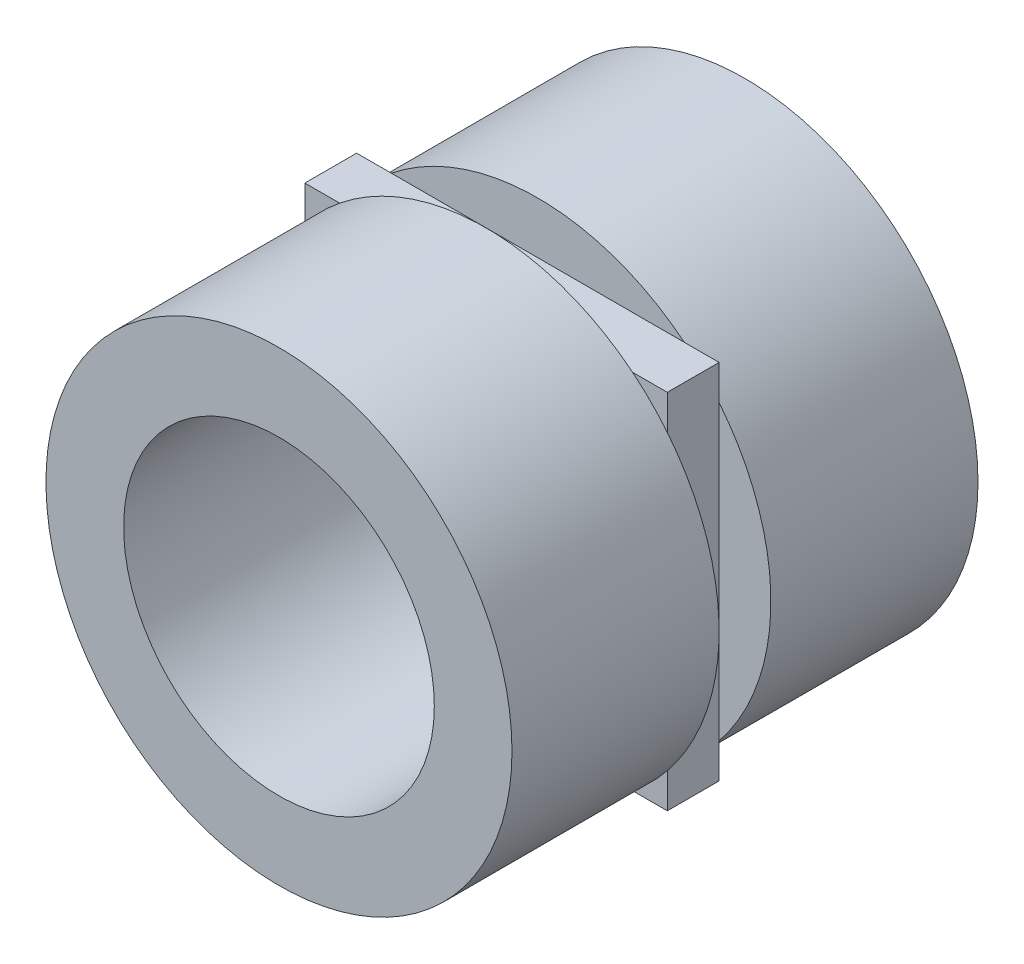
SolidWorks part; units mm, degrees
ref_plane "Plan de face" through (0, 0, 0) normal (0, 0, 1) x (1, 0, 0)
ref_plane "Plan de dessus" through (0, 0, 0) normal (0, 1, 0) x (1, 0, 0)
ref_plane "Plan de droite" through (0, 0, 0) normal (1, 0, 0) x (0, 0, -1)
sketch "Esquisse1" plane through (0, 0, 0) normal (0, 0, 1) x (1, 0, 0)
  circle A0 centre (0, 0) radius 4.5
  circle A1 centre (0, 0) radius 3
  dimension "D1" = 9
  dimension "D2" = 6
extrude "Extrusion1" add sketch "Esquisse1" along normal mid plane 9
sketch "Esquisse2" plane through (0, 0, 0) normal (0, 0, 1) x (1, 0, 0)
  line L1 (-3.5, 3.5) -> (3.5, 3.5)
  line L2 (-3.5, 3.5) -> (-3.5, -3.5)
  line L3 (-3.5, -3.5) -> (3.5, -3.5)
  line L4 (3.5, 3.5) -> (3.5, -3.5)
  dimension "D1" = 7
  dimension "D2" = 7
  dimension "D3" = 3.5
  dimension "D4" = 3.5
extrude "Enlèv. mat.-Extru.1" cut sketch "Esquisse2" against normal mid plane 1 flip side to cut
sketch "Esquisse3" plane through (0, 0, 0) normal (0, 0, 1) x (1, 0, 0)
  line L0 (-3.5, 3.5) -> (-2.8284, 3.5)
  line L1 (-3.5, 3.5) -> (-3.5, 2.8284)
  line L2 (2.8284, 3.5) -> (3.5, 3.5)
  line L3 (3.5, 3.5) -> (3.5, 2.8284)
  line L4 (3.5, -3.5) -> (3.5, -2.8284)
  line L5 (3.5, -3.5) -> (2.8284, -3.5)
  line L6 (-3.5, -3.5) -> (3.5, -3.5) construction
  line L7 (-2.8284, -3.5) -> (-3.5, -3.5)
  line L8 (-3.5, -3.5) -> (-3.5, -2.8284)
  arc A0 (-2.8284, 3.5) -> (-3.5, 2.8284) centre (0, 0) ccw
  arc A1 (3.5, 2.8284) -> (2.8284, 3.5) centre (0, 0) ccw
  arc A2 (-3.5, -2.8284) -> (-2.8284, -3.5) centre (0, 0) ccw
  arc A3 (2.8284, -3.5) -> (3.5, -2.8284) centre (0, 0) ccw
extrude "Extrusion2" add sketch "Esquisse3" along normal mid plane 1
